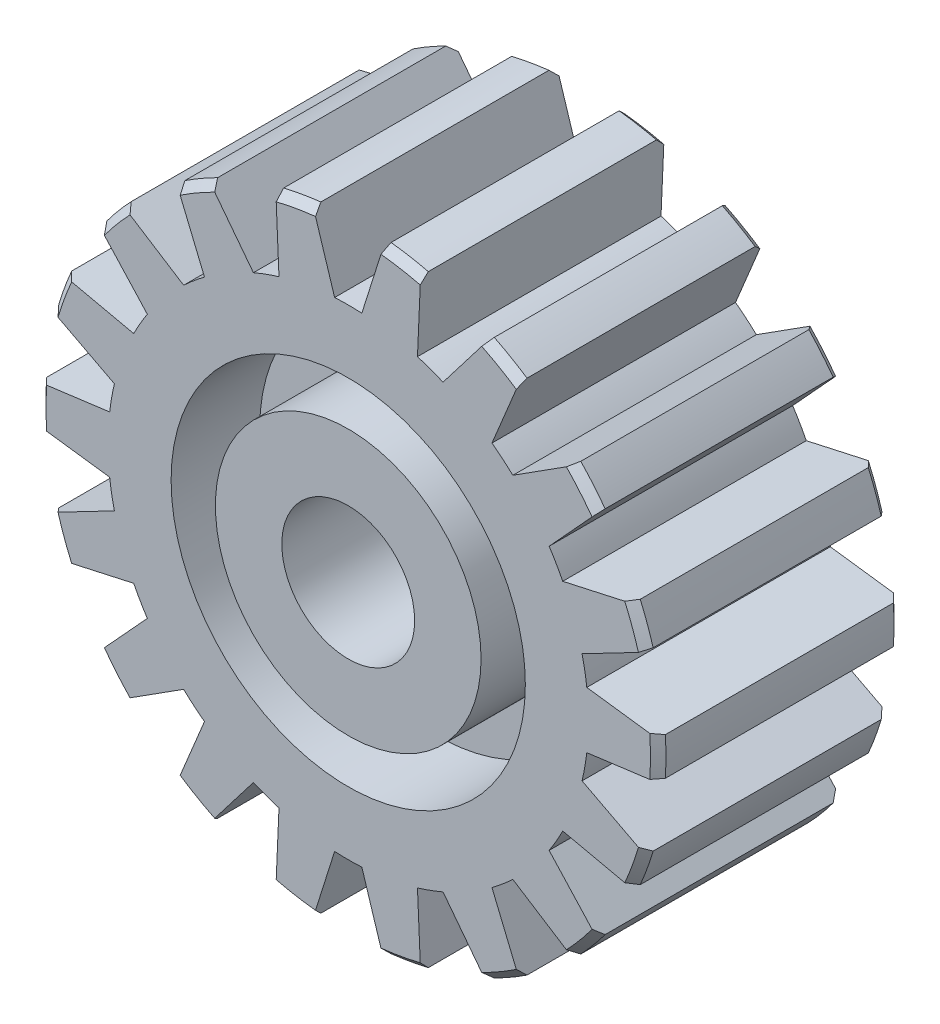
SolidWorks part; units mm, degrees
ref_plane "Plan1" through (0, 0, 0) normal (0, 0, 1) x (1, 0, 0)
ref_plane "Plan2" through (0, 0, 0) normal (0, 1, 0) x (1, 0, 0)
ref_plane "Plan3" through (0, 0, 0) normal (1, 0, 0) x (0, 0, -1)
sketch "Diamètre primitif" plane through (0, 0, 0) normal (0, 0, 1) x (1, 0, 0)
  line L0 (0, 0) -> (0.7, 0) construction
  circle A0 centre (0, 0) radius 6.3
  point P3 (0, 0)
  dimension "D1" = 12.6
  dimension "D2" = 0.7
sketch "Esquisse2" plane through (0, 0, 0) normal (0, 0, 1) x (1, 0, 0)
  circle A0 centre (0, 0) radius 7
  dimension "D1" = 14
extrude "Diamètre de tête" add sketch "Esquisse2" along normal mid plane 5.5
chamfer "Chanfreins" distance 0.175 angle 45
sketch "Esquisse3" plane through (0, 0, 0) normal (0, 0, 1) x (1, 0, 0)
  line L0 (0, 0) -> (0, 7) construction
  line L1 (-0.3072, 5.4163) -> (-0.7924, 6.955)
  line L2 (0.3072, 5.4163) -> (0.7924, 6.955)
  arc A0 (0.3072, 5.4163) -> (-0.3072, 5.4163) centre (0, 0) ccw
  circle A1 centre (0, 0) radius 7 construction
  arc A2 (0.7924, 6.955) -> (-0.7924, 6.955) centre (0, 0) ccw
  point P1 (-0.5498, 6.1857)
  point P10 (0.5498, 6.1857)
  dimension "D1" = 10.85
  dimension "D2" = 1.0996
  dimension "D3" = 325
extrude "Creux dent" cut sketch "Esquisse3" against normal through all and the other way through all
pattern_circular "Répétition" count 18 over 360
sketch "Esquisse4" plane through (0, 0, 2.75) normal (0, 0, 1) x (1, 0, 0)
  circle A0 centre (0, 0) radius 1.5
  dimension "D1" = 3
extrude "Passage axe" cut sketch "Esquisse4" against normal through all
sketch "Esquisse5" plane through (0, 0, 2.75) normal (0, 0, 1) x (1, 0, 0)
  circle A0 centre (0, 0) radius 3
  dimension "D1" = 6
extrude "Gorge" cut sketch "Esquisse5" against normal blind 2 thin
mirror "Symétrie gorge" about plane through (0, 0, 0) normal (0, 0, 1)
equation "\"D1@Esquisse2\" = \"D1@Diamètre primitif\" + 2 * \"D2@Diamètre primitif\""
equation "\"D1@Chanfreins\" = 0.25*\"D2@Diamètre primitif\""
equation "\"D1@Esquisse3\" = \"D1@Diamètre primitif\"-2.5*\"D2@Diamètre primitif\""
equation "\"D2@Esquisse3\"=3.14159*\"D2@Diamètre primitif\"/2"
equation "\"D1@Répétition\" = \"D1@Diamètre primitif\"/\"D2@Diamètre primitif\""
